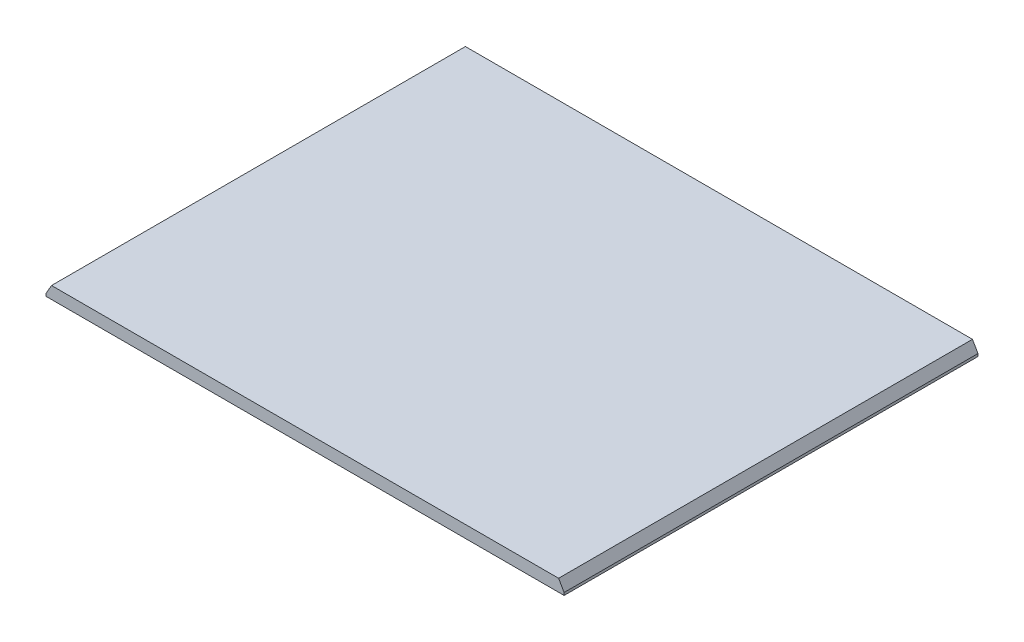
SolidWorks part; units mm, degrees
ref_plane "Front Plane" through (0, 0, 0) normal (1, 0, 0) x (0, 1, 0)
ref_plane "Top Plane" through (0, 0, 0) normal (0, 0, 1) x (0, 1, 0)
ref_plane "Right Plane" through (0, 0, 0) normal (0, 1, 0) x (-1, 0, 0)
sketch "sk w193" plane through (0, 0, 0) normal (0, 0, 1) x (0, 1, 0)
  point P0 (-399.034, -196.596)
  point P3 (-188.214, 0)
  line B0 (-399.034, -196.596) -> (-399.034, -160.02)
  line B1 (-399.034, -160.02) -> (-226.06, -160.02)
  line B2 (-210.82, -144.78) -> (-210.82, 144.78)
  line B3 (-226.06, 160.02) -> (-399.034, 160.02)
  line B4 (-399.034, 160.02) -> (-399.034, 196.596)
  line B5 (-399.034, 196.596) -> (0, 196.596)
  line B6 (0, 196.596) -> (0, 160.02)
  line B7 (0, 160.02) -> (-172.974, 160.02)
  line B8 (-188.214, 144.78) -> (-188.214, -144.78)
  line B9 (-172.974, -160.02) -> (0, -160.02)
  line B10 (0, -160.02) -> (0, -196.596)
  line B11 (0, -196.596) -> (-399.034, -196.596)
  arc B12 (-226.06, -160.02) -> (-210.82, -144.78) centre (-226.06, -144.78) ccw
  arc B13 (-210.82, 144.78) -> (-226.06, 160.02) centre (-226.06, 144.78) ccw
  arc B14 (-172.974, 160.02) -> (-188.214, 144.78) centre (-172.974, 144.78) ccw
  arc B15 (-188.214, -144.78) -> (-172.974, -160.02) centre (-172.974, -144.78) ccw
sketch_block_instance "w14x193-1-1"
sketch_block "w14x193-1" parameters "D4"=15.24, "D1"=399.034, "D2"=393.192, "D3"=22.606, "D5"=36.576
sketch "Sketch2" plane through (0, 0, 0) normal (0, 0, 1) x (0, 1, 0)
  line L0 (320, 501.4782) -> (320, -809.7231)
  line L1 (-188.214, 144.78) -> (-188.214, -144.78)
  line L2 (-188.214, -144.78) -> (-172.974, -160.02)
  line L3 (-172.974, -160.02) -> (5, -160.02)
  line L4 (-188.214, 144.78) -> (-172.974, 160.02)
  line L5 (-172.974, 160.02) -> (5, 160.02)
  line L6 (5, 201.596) -> (5, 160.02)
  line L7 (0, 196.596) -> (0, 160.02) construction
  line L8 (5, -160.02) -> (5, -201.596)
  line L9 (-285.82, 201.596) -> (5, 201.596)
  line L10 (-285.82, -201.596) -> (5, -201.596)
  line L11 (-285.82, 201.596) -> (-285.82, 239.696)
  line L12 (-285.82, 239.696) -> (167.6, 501.4782)
  line L13 (-285.82, -201.596) -> (-285.82, -239.696)
  line L14 (-285.82, -239.696) -> (167.6, -809.7231)
  line L15 (-210.82, -144.78) -> (-210.82, 144.78) construction
  line L16 (-399.034, 196.596) -> (0, 196.596) construction
  line L17 (0, -196.596) -> (-399.034, -196.596) construction
  line L18 (320, 501.4782) -> (167.6, 501.4782)
  line L19 (320, -809.7231) -> (167.6, -809.7231)
  point P30 (320, 501.4782)
  point P31 (320, -809.7231)
  dimension "D1" = 320
  dimension "D2" = 5
  dimension "D3" = 75
  dimension "D4" = 5
  dimension "D5" = 5
  dimension "D6" = 30
  dimension "D7" = 51.5
  dimension "D8" = 38.1
  dimension "D9" = 38.1
  dimension "D10" = 152.4
sketch "Sketch3" plane through (0, 0, 0) normal (0, 1, 0) x (-1, 0, 0)
  line L6 (-541.5415, 432.6) -> (541.5415, 432.6)
  line L7 (-541.5415, 432.6) -> (-541.5415, -432.6)
  line L8 (-541.5415, -432.6) -> (541.5415, -432.6)
  line L9 (541.5415, 432.6) -> (541.5415, -432.6)
  point P4 (0, 432.6)
  point P5 (541.5415, 0)
  dimension "D1" = 865.2
  dimension "D2" = 1083.083
extrude "Boss-Extrude1" add sketch "Sketch3" along normal blind 25.4
chamfer "Chamfer1" distance 20 angle 30 2 edges at (-541.5415, 25.4, 0) (541.5415, 25.4, 0)
